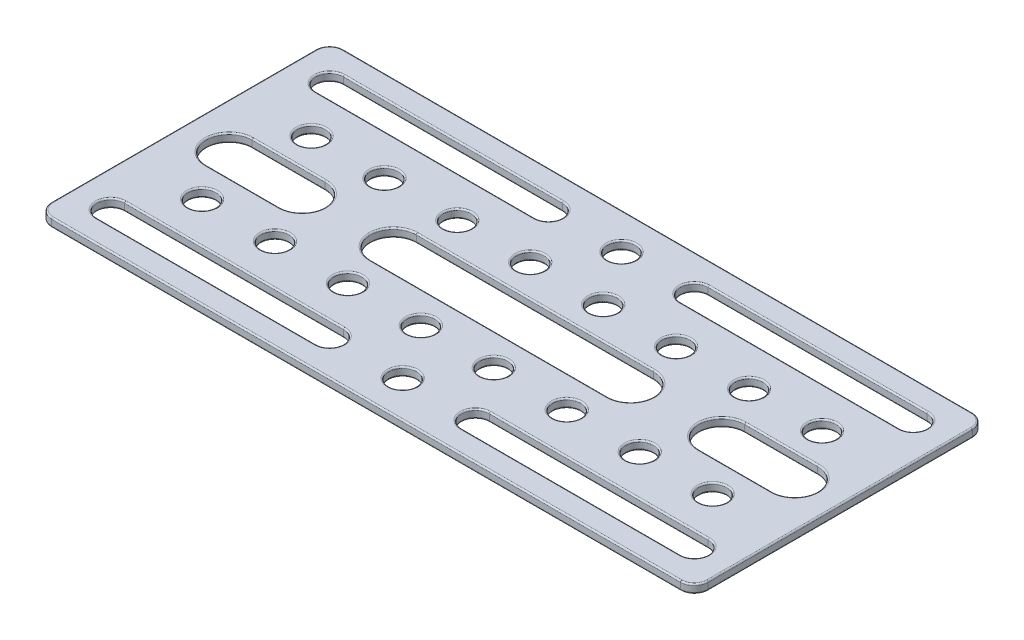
SolidWorks part; units mm, degrees
ref_plane "Front" through (0, 0, 0) normal (0, 0, 1) x (1, 0, 0)
ref_plane "Top" through (0, 0, 0) normal (0, 1, 0) x (1, 0, 0)
ref_plane "Right" through (0, 0, 0) normal (1, 0, 0) x (0, 0, -1)
sketch "Sketch1" plane through (0, 0, 0) normal (0, 1, 0) x (1, 0, 0)
  line L1 (2.413, 0) -> (111.887, 0)
  line L2 (0, 2.413) -> (0, 48.387)
  line L3 (2.413, 50.8) -> (111.887, 50.8)
  line L4 (114.3, 2.413) -> (114.3, 48.387)
  line L5 (7.9121, 29.3751) -> (20.6121, 29.3751)
  line L7 (7.9121, 21.4249) -> (20.6121, 21.4249)
  line L9 (36.5125, 29.3751) -> (77.7875, 29.3751)
  line L11 (36.5125, 21.4249) -> (77.7875, 21.4249)
  line L13 (93.6879, 29.3751) -> (106.3879, 29.3751)
  line L15 (93.6879, 21.4249) -> (106.3879, 21.4249)
  arc A0 (0, 48.387) -> (2.413, 50.8) centre (2.413, 48.387) cw
  arc A1 (2.413, 0) -> (0, 2.413) centre (2.413, 2.413) cw
  arc A2 (111.887, 0) -> (114.3, 2.413) centre (111.887, 2.413) ccw
  arc A3 (111.887, 50.8) -> (114.3, 48.387) centre (111.887, 48.387) cw
  arc A4 (7.9121, 29.3751) -> (7.9121, 21.4249) centre (7.9121, 25.4) ccw
  arc A5 (20.6121, 21.4249) -> (20.6121, 29.3751) centre (20.6121, 25.4) ccw
  arc A6 (36.5125, 29.3751) -> (36.5125, 21.4249) centre (36.5125, 25.4) ccw
  arc A7 (77.7875, 21.4249) -> (77.7875, 29.3751) centre (77.7875, 25.4) ccw
  arc A8 (93.6879, 29.3751) -> (93.6879, 21.4249) centre (93.6879, 25.4) ccw
  arc A9 (106.3879, 21.4249) -> (106.3879, 29.3751) centre (106.3879, 25.4) ccw
  point P6 (0, 50.8)
  point P9 (0, 0)
  point P14 (114.3, 50.8)
  point P28 (0, 0)
  dimension "D3" = 2.413
  dimension "D1" = 50.8
  dimension "D2" = 114.3
  dimension "D4" = 12.7
  dimension "D5" = 41.275
  dimension "D6" = 15.9004
  dimension "D7" = 15.9004
  dimension "D8" = 7.9502
  dimension "D9" = 36.5125
  dimension "D10" = 21.4249
extrude "Extrude1" add sketch "Sketch1" along normal blind 1.524
sketch "Sketch2" plane through (0, 1.524, 0) normal (0, 1, 0) x (-1, 0, 0)
  line L0 (-2.413, 0) -> (-111.887, 0) construction
  line L1 (-6.35, -8.763) -> (-44.45, -8.763)
  line L3 (-6.35, -3.937) -> (-44.45, -3.937)
  line L5 (-69.85, -3.937) -> (-107.95, -3.937)
  line L7 (-69.85, -8.763) -> (-107.95, -8.763)
  line L9 (0, -48.387) -> (0, -2.413) construction
  line L10 (-114.3, -2.413) -> (-114.3, -48.387) construction
  circle A0 centre (-57.15, -6.35) radius 2.413
  arc A1 (-6.35, -8.763) -> (-6.35, -3.937) centre (-6.35, -6.35) ccw
  arc A2 (-44.45, -3.937) -> (-44.45, -8.763) centre (-44.45, -6.35) ccw
  arc A3 (-69.85, -8.763) -> (-69.85, -3.937) centre (-69.85, -6.35) ccw
  arc A4 (-107.95, -3.937) -> (-107.95, -8.763) centre (-107.95, -6.35) ccw
  dimension "D2" = 4.826
  dimension "D1" = 38.1
  dimension "D3" = 4.826
  dimension "D4" = 6.35
  dimension "D5" = 6.35
  dimension "D6" = 6.35
  dimension "D7" = 57.15
extrude "Cut-Extrude1" cut sketch "Sketch2" against normal through all
sketch "Sketch3" plane through (0, 1.524, 0) normal (0, 1, 0) x (-1, 0, 0)
  line L0 (0, -48.387) -> (0, -2.413) construction
  line L1 (-2.413, 0) -> (-111.887, 0) construction
  circle A0 centre (-12.7, -15.875) radius 2.413
  arc A1 (-7.9121, -29.3751) -> (-7.9121, -21.4249) centre (-7.9121, -25.4) ccw construction
  dimension "D1" = 4.826
  dimension "D2" = 12.7
  dimension "D3" = 15.875
extrude "Cut-Extrude2" cut sketch "Sketch3" against normal through all
pattern_linear "LPattern1" count 8 spacing 12.7 along (1, 0, 0) of "Cut-Extrude2"
ref_plane "Plane1" through (0, 0, -25.4) normal (0, 0, 1) x (1, 0, 0)
mirror "Mirror1" about plane through (0, 0, -25.4) normal (0, 0, 1) of "LPattern1", "Cut-Extrude1", "Cut-Extrude2"
fillet "Fillet1" radius 0.254 108 edges at (0.7068, 1.524, -0.7068) (12.7, 0, -13.462) (12.7, 1.524, -13.462) (25.4, 1.524, -13.462) (25.4, 0, -13.462) (38.1, 0, -13.462) (38.1, 1.524, -13.462) (50.8, 0, -13.462) (50.8, 1.524, -13.462) (63.5, 0, -13.462) (63.5, 1.524, -13.462) (76.2, 0, -13.462) (76.2, 1.524, -13.462) (88.9, 0, -13.462) (88.9, 1.524, -13.462) (101.6, 0, -13.462) (101.6, 1.524, -13.462) (3.937, 1.524, -44.45) (25.4, 1.524, -46.863) (46.863, 1.524, -44.45) (25.4, 1.524, -42.037) (3.937, 0, -44.45) (25.4, 0, -46.863) (46.863, 0, -44.45) (25.4, 0, -42.037) (57.15, 1.524, 0) (67.437, 1.524, -44.45) (88.9, 1.524, -46.863) (110.363, 1.524, -44.45) (88.9, 1.524, -42.037) (67.437, 0, -44.45) (88.9, 0, -46.863) (110.363, 0, -44.45) (88.9, 0, -42.037) (57.15, 1.524, -46.863) (57.15, 0, -46.863) (12.7, 1.524, -37.338) (12.7, 0, -37.338) (25.4, 1.524, -37.338) (25.4, 0, -37.338) (113.5932, 1.524, -0.7068) (38.1, 1.524, -37.338) (38.1, 0, -37.338) (50.8, 1.524, -37.338) (50.8, 0, -37.338) (63.5, 1.524, -37.338) (63.5, 0, -37.338) (76.2, 1.524, -37.338) (76.2, 0, -37.338) (88.9, 1.524, -37.338) (88.9, 0, -37.338) (101.6, 1.524, -37.338) (101.6, 0, -37.338) (114.3, 1.524, -25.4) (113.5932, 1.524, -50.0932) (3.937, 0, -25.4) (14.2621, 0, -21.4249) (24.5872, 0, -25.4) (14.2621, 0, -29.3751) (3.937, 1.524, -25.4) (14.2621, 1.524, -21.4249) (57.15, 1.524, -50.8) (24.5872, 1.524, -25.4) (14.2621, 1.524, -29.3751) (32.5374, 0, -25.4) (57.15, 0, -21.4249) (81.7626, 0, -25.4) (57.15, 0, -29.3751) (32.5374, 1.524, -25.4) (57.15, 1.524, -21.4249) (81.7626, 1.524, -25.4) (57.15, 1.524, -29.3751) (0.7068, 1.524, -50.0932) (89.7128, 0, -25.4) (100.0379, 0, -21.4249) (110.363, 0, -25.4) (100.0379, 0, -29.3751) (89.7128, 1.524, -25.4) (100.0379, 1.524, -21.4249) (110.363, 1.524, -25.4) (100.0379, 1.524, -29.3751) (57.15, 0, -50.8) (0, 1.524, -25.4) (3.937, 0, -6.35) (25.4, 0, -8.763) (46.863, 0, -6.35) (25.4, 0, -3.937) (3.937, 1.524, -6.35) (25.4, 1.524, -3.937) (113.5932, 0, -50.0932) (46.863, 1.524, -6.35) (25.4, 1.524, -8.763) (114.3, 0, -25.4) (113.5932, 0, -0.7068) (67.437, 0, -6.35) (88.9, 0, -8.763) (110.363, 0, -6.35) (57.15, 0, 0) (88.9, 0, -3.937) (67.437, 1.524, -6.35) (88.9, 1.524, -3.937) (110.363, 1.524, -6.35) (88.9, 1.524, -8.763) (0.7068, 0, -0.7068) (0, 0, -25.4) (57.15, 0, -3.937) (57.15, 1.524, -3.937) (0.7068, 0, -50.0932)
